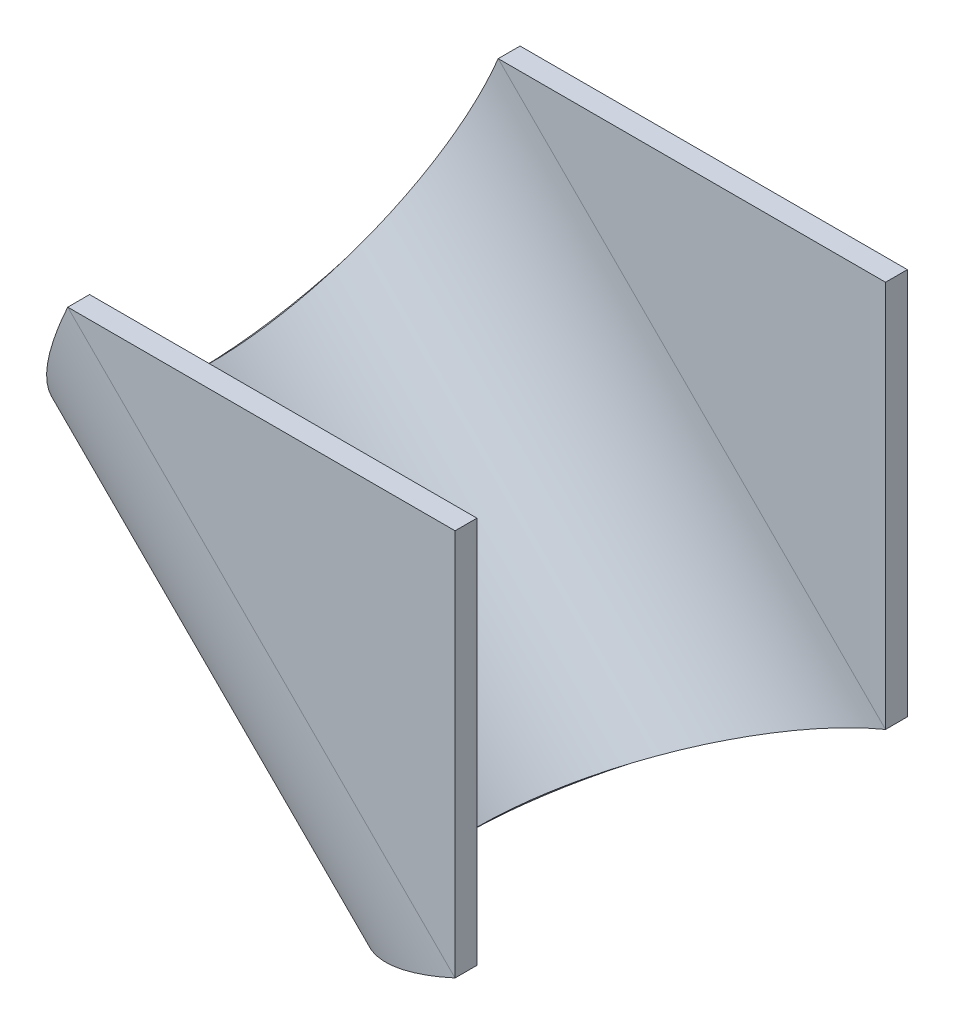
SolidWorks part; units mm, degrees
ref_plane "前视基准面" through (0, 0, 0) normal (0, 0, 1) x (1, 0, 0)
ref_plane "上视基准面" through (0, 0, 0) normal (0, 1, 0) x (1, 0, 0)
ref_plane "右视基准面" through (0, 0, 0) normal (1, 0, 0) x (0, 0, -1)
imported_body "基体零件-带补料的垂直四通管-1"
sheet metal parameters "钣金1" parameters "D1"=0.7366, "厚度"=1
bend "圆角折弯1" bend radius 9.3514 bend angle 180 parameters "D5"=1
flatten bends "展开-折弯1"
sketch "尖角-草图1" plane through (0, 0, -9.3514) normal (0, 0, 1) x (1, 0, 0)
  line L0 (-28.115, -10.3868) -> (-10.3868, -28.115) construction
  dimension "D1" = 0
process bends "加工-折弯1" parameters "D1"=0
sketch "平面-草图1" plane through (0, 0, -9.3514) normal (0, 0, 1) x (1, 0, 0)
flat pattern "平板型式1"
sketch "折弯-线1" plane through (0, 0, 0) normal (0, 1, 0) x (-1, 0, 0)
bend of the flat pattern "展开-<圆角折弯1>1"
